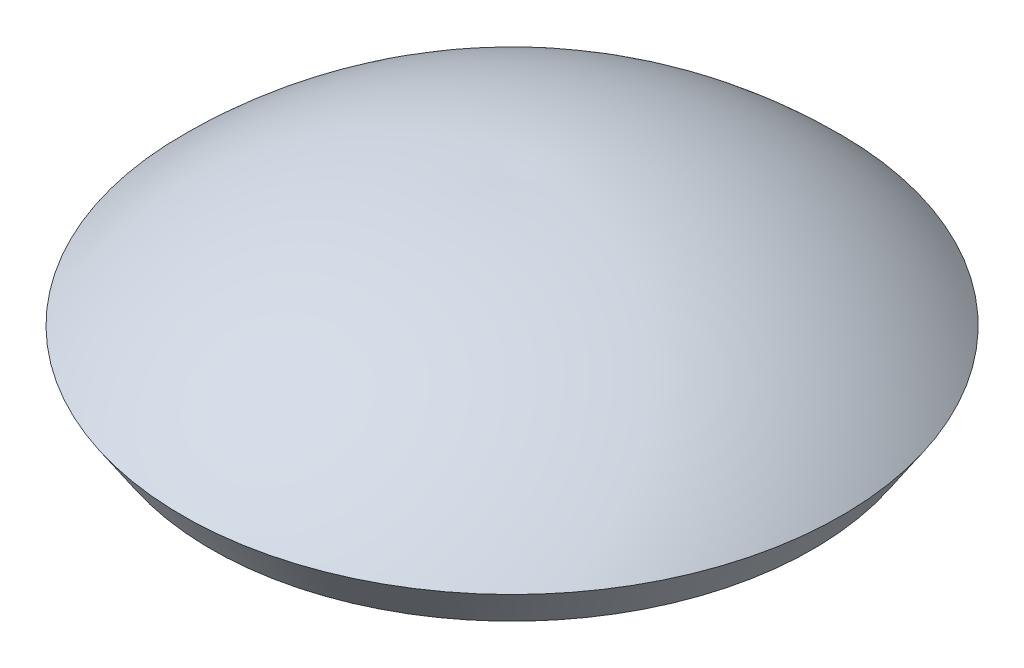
SolidWorks part; units mm, degrees
ref_plane "LAT. ESQUERDO" through (0, 0, 0) normal (0, 0, 1) x (1, 0, 0)
ref_plane "SUPERIOR" through (0, 0, 0) normal (0, 1, 0) x (1, 0, 0)
ref_plane "FRONTAL" through (0, 0, 0) normal (1, 0, 0) x (0, 0, -1)
sketch "Esboço1" plane through (0, 0, 0) normal (0, 0, 1) x (1, 0, 0)
  line L0 (-18.9, 0) -> (18.9, 0) construction
  line L1 (0, 0) -> (0, 7.4) construction
  line L2 (0, 7.4) -> (0, 4.4)
  line L3 (17.2417, -2.5) -> (18.9, 0)
  arc A0 (0, 7.4) -> (18.9, 0) centre (1.1201, -17.5749) cw
  arc A1 (0, 4.4) -> (17.2417, -2.5) centre (0, -20.5917) cw
  dimension "D3" = 25
  dimension "D1" = 37.8
  dimension "D2" = 7.4
  dimension "D4" = 3
  dimension "D5" = 2.5
sketch "Esboço2" plane through (0, 0, 0) normal (0, 1, 0) x (1, 0, 0)
  line L0 (0, 18.9) -> (0, -18.9) construction
  line L2 (-18.9, 0) -> (18.9, 0) construction
  circle A0 centre (0, 0) radius 18.9
sweep "Varredura1" add profiles "Esboço1" path "Esboço2"
